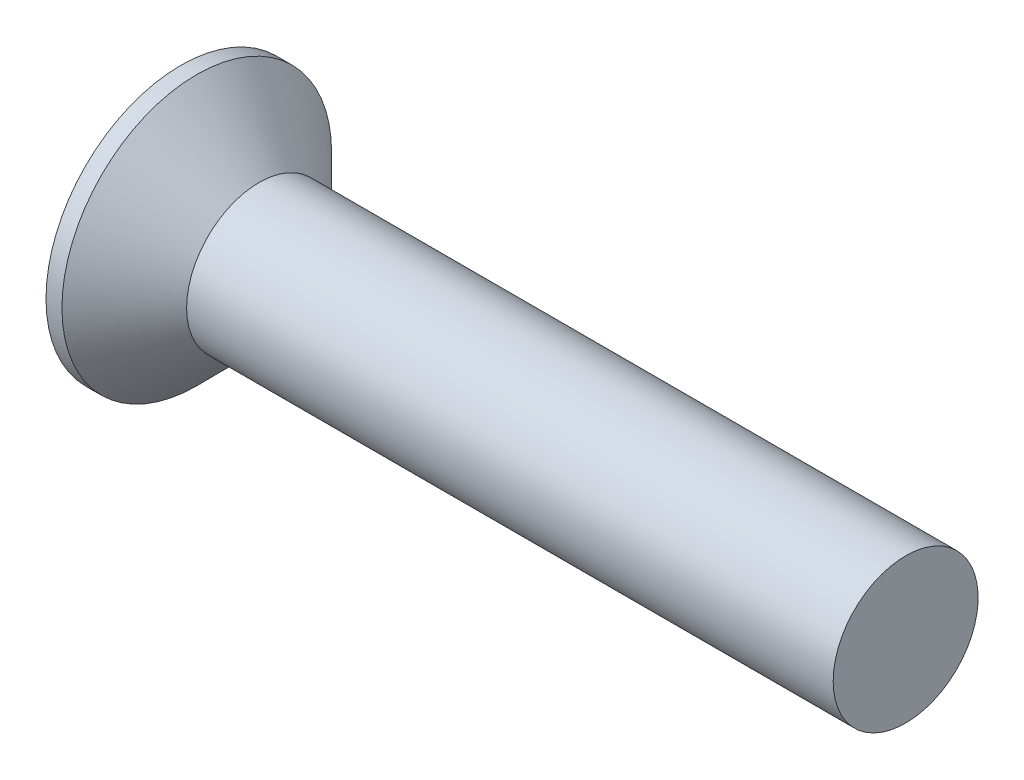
SolidWorks part; units mm, degrees
ref_plane "Plane1" through (0, 0, 0) normal (0, 0, 1) x (1, 0, 0)
ref_plane "Plane2" through (0, 0, 0) normal (0, 1, 0) x (1, 0, 0)
ref_plane "Plane3" through (0, 0, 0) normal (1, 0, 0) x (0, 0, -1)
revolve "Base-Revolve" add sketch "BodySke" angle 360 about L5
sketch "BodySke" plane through (0, 0, 0) normal (0, 0, 1) x (1, 0, 0)
  line L0 (0, 0) -> (0, 4.65)
  line L1 (0, 4.65) -> (0.55, 4.65)
  line L2 (2.7, 2.5) -> (25, 2.5)
  line L3 (25, 2.5) -> (25, 0)
  line L4 (25, 0) -> (0, 0)
  line L5 (-6.35, 0) -> (82.55, 0) construction
  line L6 (2.7, -2.5) -> (25, -2.5) construction
  line L7 (0.55, -4.65) -> (2.7, -2.5) construction
  line L8 (0.55, 4.65) -> (2.7, 2.5)
  line L9 (0, -4.65) -> (0.55, -4.65) construction
  line L10 (3.5, 4.0875) -> (3.5, -5.4375) construction
  line L11 (0, 6.35) -> (0, -3.175) construction
  dimension "Diameter" = 5
  dimension "Length" = 25
  dimension "Head_ht" = 2.7
  dimension "Head_dia" = 9.3
  dimension "Head_ang" = 90
  dimension "D6" = 0.55
  dimension "Advance" = 0.8
  dimension "Thread_nom" = 25
extrude "Slot" cut sketch "Sketch2" against normal blind 1.4
sketch "Sketch2" plane through (0, 0, 0) normal (-1, 0, 0) x (0, 0, 1)
  line L0 (-4.65, -0.75) -> (4.65, -0.75)
  line L1 (-4.65, -0.75) -> (-4.65, 0.75)
  line L2 (4.65, 0.75) -> (-4.65, 0.75)
  line L3 (4.65, 0.75) -> (4.65, -0.75)
  dimension "D1" = 0.75
  dimension "Slot_width" = 1.5
  dimension "D2" = 9.3
  dimension "D3" = 4.65
sketch "Sketch3" plane through (0, 0, 0) normal (-1, 0, 0) x (0, 0, 1)
  line L0 (-0.52, 2.53) -> (0.52, 2.53)
  line L1 (0.52, 2.53) -> (0.52, -2.53)
  line L2 (0.52, -2.53) -> (-0.52, -2.53)
  line L3 (-0.52, -2.53) -> (-0.52, 2.53)
  dimension "D1" = 2.53
  dimension "Cross_dia" = 5.06
  dimension "D2" = 0.52
  dimension "Cross_width" = 1.04
ref_plane "Plane4" through (3.35, 0, 0) normal (-1, 0, 0) x (0, 0, 1)
sketch "Sketch4" plane through (3.35, 0, 0) normal (-1, 0, 0) x (0, 0, 1)
  line L0 (-0.26, 0.26) -> (0.26, 0.26)
  line L3 (0.26, 0.26) -> (0.26, -0.26)
  line L4 (0.26, -0.26) -> (-0.26, -0.26)
  line L5 (-0.26, -0.26) -> (-0.26, 0.26)
  dimension "D1" = 0.52
  dimension "D2" = 0.52
  dimension "D3" = 0.26
  dimension "D4" = 0.26
loft "Cross" cut profiles "Sketch3", "Sketch4"
pattern_circular "CirPattern1" count 2 every 90 about axis through (0, 0, 0) along (1, 0, 0) of "Cross"
sketch "ThdSchSke" plane through (0, 0, 0) normal (0, 0, 1) x (1, 0, 0)
  line L0 (3.5, -2.055) -> (3.1884, -2.5)
  line L1 (3.5, -2.055) -> (3.8116, -2.5)
  line L2 (3.8116, -2.5) -> (3.8116, -3.125)
  line L3 (-3.175, 0) -> (5.1513, 0) construction
  line L5 (3.8116, -3.125) -> (3.1884, -3.125)
  line L6 (3.1884, -3.125) -> (3.1884, -2.5)
  line L7 (0, 4.65) -> (0, -4.65) construction
  dimension "Thread_minor" = 4.11
  dimension "Diameter" = 5
  dimension "Start" = 3.5
  dimension "SideAngle" = 55
  dimension "VeeAngle" = 70
  dimension "Overcut" = 6.25
revolve "ThreadSchematic" [suppressed] cut sketch "ThdSchSke" angle 360 about L3
pattern_linear "ThdSchPat" [suppressed]
equation "\"D1@Sketch3\" = \"Cross_dia@Sketch3\" / 2"
equation "\"D2@Sketch3\" = \"Cross_width@Sketch3\" / 2"
equation "\"D1@Sketch4\" = \"Cross_width@Sketch3\" *.5"
equation "\"D2@Sketch4\" = \"D1@Sketch4\""
equation "\"D4@Sketch4\" = \"D2@Sketch4\" / 2"
equation "\"D3@Sketch4\" = \"D1@Sketch4\" / 2"
equation "\"D1@Sketch2\" = \"Slot_width@Sketch2\" / 2"
equation "\"D2@Sketch2\" = \"Head_dia@BodySke\""
equation "\"D3@Sketch2\" = \"D2@Sketch2\" / 2"
equation "\"Thread_length@ThreadCosmetic\" = ((sgn( (\"Length@BodySke\" - \"Advance@BodySke\" - \"Head_ht@BodySke\" ) - \"Thread_nom@BodySke\" )-1)*( (\"Length@BodySke\" - \"Advance@BodySke\" - \"Head_ht@BodySke\" ) - \"Thread_"
equation "\"Thread_minor@ThdSchSke\" = \"Thread_minor@ThreadCosmetic\""
equation "\"Diameter@ThdSchSke\" = \"Diameter@BodySke\""
equation "\"Overcut@ThdSchSke\" = \"Diameter@BodySke\" * 1.25"
equation "\"Start@ThdSchSke\" = 0.000001 + \"Length@BodySke\" - \"Thread_length@ThreadCosmetic\"  '---Countersunk---"
equation "\"Num_threads@ThdSchPat\" = int( \"Thread_length@ThreadCosmetic\" / \"Advance@BodySke\" + 0.999 )  + 1"
equation "\"Advance@ThdSchPat\" = \"Thread_length@ThreadCosmetic\" /  (\"Num_threads@ThdSchPat\" - 1) 'relax it"
